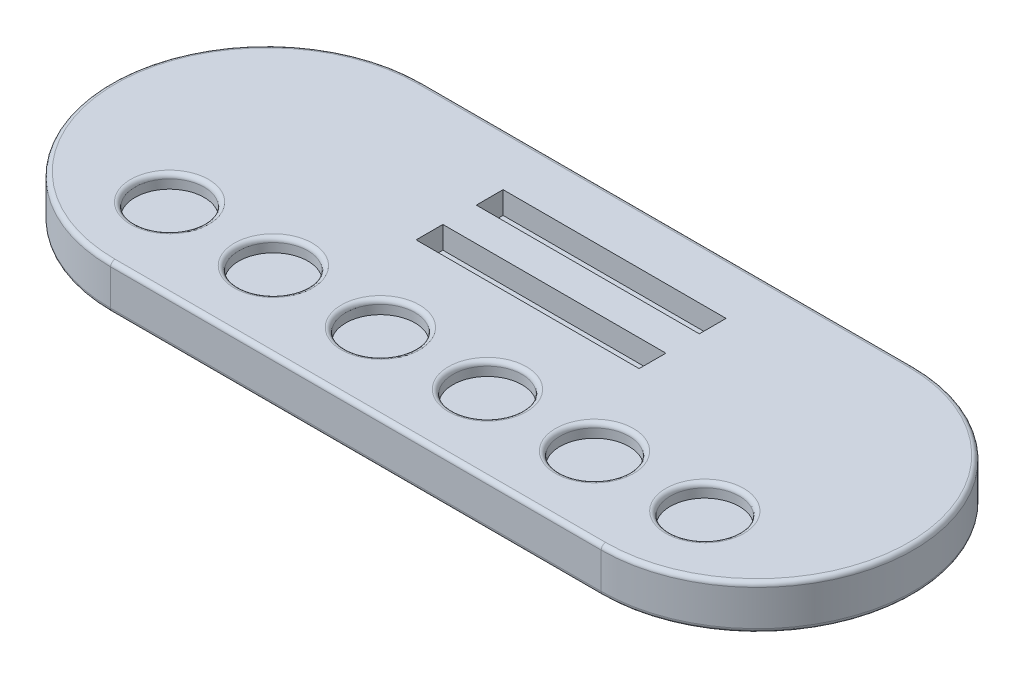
SolidWorks part; units mm, degrees
ref_plane "Front Plane" through (0, 0, 0) normal (0, 0, 1) x (1, 0, 0)
ref_plane "Top Plane" through (0, 0, 0) normal (0, 1, 0) x (1, 0, 0)
ref_plane "Right Plane" through (0, 0, 0) normal (1, 0, 0) x (0, 0, -1)
body saved out of another part "Stock-Final Toy Scales-1"
